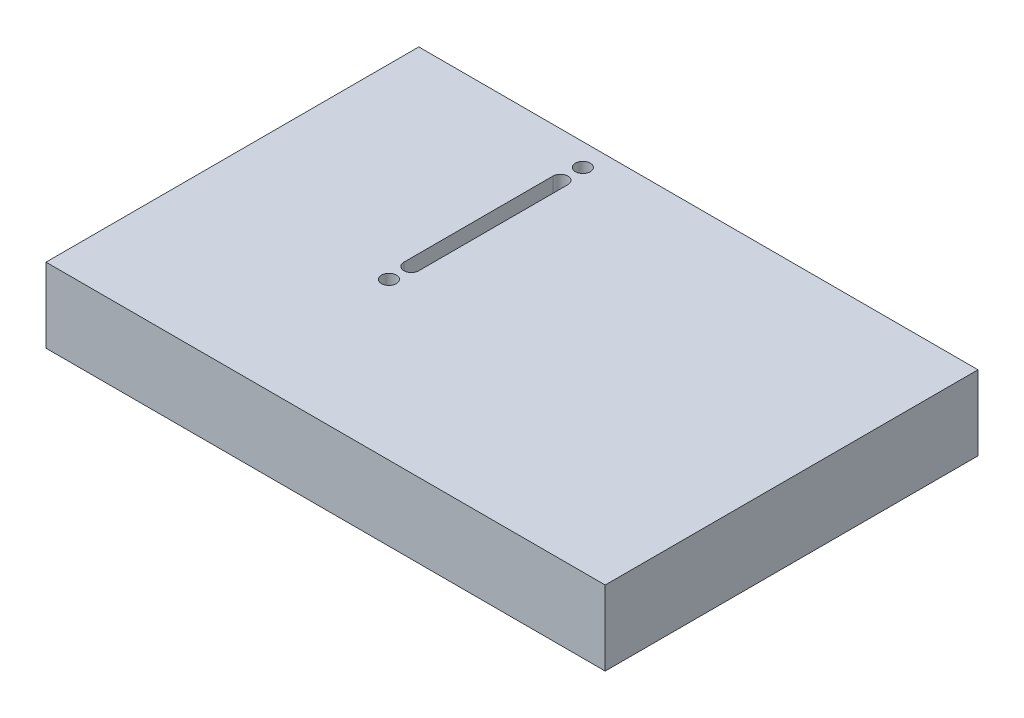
SolidWorks part; units mm, degrees
ref_plane "Front Plane" through (0, 0, 0) normal (0, 0, 1) x (1, 0, 0)
ref_plane "Top Plane" through (0, 0, 0) normal (0, 1, 0) x (1, 0, 0)
ref_plane "Right Plane" through (0, 0, 0) normal (1, 0, 0) x (0, 0, -1)
sketch "Sketch1" plane through (0, 0, 0) normal (0, 1, 0) x (1, 0, 0)
  line L1 (-9.525, -6.35) -> (9.525, -6.35)
  line L2 (-9.525, -6.35) -> (-9.525, 6.35)
  line L3 (-9.525, 6.35) -> (9.525, 6.35)
  line L4 (9.525, -6.35) -> (9.525, 6.35)
  line L5 (-9.525, -6.35) -> (9.525, 6.35) construction
  line L6 (-9.525, 6.35) -> (9.525, -6.35) construction
  point P0 (0, 0)
  dimension "D1" = 12.7
  dimension "D2" = 19.05
extrude "Boss-Extrude1" add sketch "Sketch1" along normal blind 2.54
sketch "Sketch2" plane through (0, 2.54, 0) normal (0, 1, 0) x (1, 0, 0)
  line L0 (-3.175, 4.826) -> (-3.175, -0.254) construction
  line L1 (-2.921, 4.826) -> (-2.921, -0.254)
  line L2 (-3.429, 4.826) -> (-3.429, -0.254)
  line L3 (-9.525, 6.35) -> (-9.525, -6.35) construction
  line L4 (-2.921, 2.286) -> (-2.0013, 2.286) construction
  line L5 (9.525, 6.35) -> (-9.525, 6.35) construction
  arc A0 (-2.921, 4.826) -> (-3.429, 4.826) centre (-3.175, 4.826) ccw
  arc A1 (-3.429, -0.254) -> (-2.921, -0.254) centre (-3.175, -0.254) ccw
  circle A2 centre (-3.175, -1.016) radius 0.254
  circle A3 centre (-3.175, 5.588) radius 0.254
  point P2 (-3.175, 2.286)
  dimension "D1" = 0.254
  dimension "D4" = 0.508
  dimension "D6" = 1.524
  dimension "D2" = 5.08
  dimension "D3" = 6.35
  dimension "D5" = 0.762
extrude "Cut-Extrude1" cut sketch "Sketch2" against normal through all
